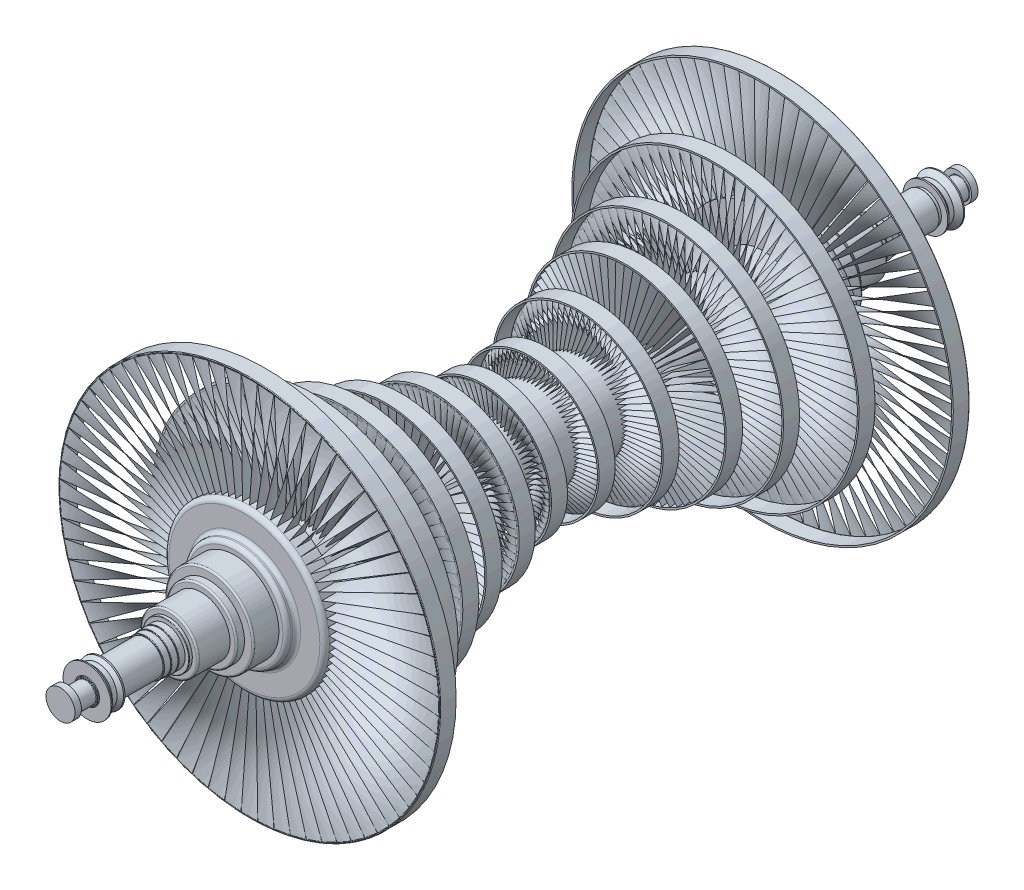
SolidWorks part; units mm, degrees
ref_plane "Front Plane" through (0, 0, 0) normal (0, 0, 1) x (1, 0, 0)
ref_plane "Top Plane" through (0, 0, 0) normal (0, 1, 0) x (1, 0, 0)
ref_plane "Right Plane" through (0, 0, 0) normal (1, 0, 0) x (0, 0, -1)
sketch "Sketch1" plane through (0, 0, 0) normal (0, 0, 1) x (1, 0, 0)
  circle A0 centre (0, 0) radius 50
  dimension "D1" = 100
extrude "Boss-Extrude1" add sketch "Sketch1" along normal blind 10
ref_plane "Plane1" through (0, 48, 0) normal (0, 1, 0) x (1, 0, 0)
ref_plane "Plane2" through (0, 118, 0) normal (0, 1, 0) x (1, 0, 0)
sketch "Sketch3" plane through (0, 48, 0) normal (0, 1, 0) x (1, 0, 0)
  line L0 (0, -10) -> (0, 0)
  line L1 (-50, -10) -> (50, -10) construction
  dimension "D1" = 10
sketch "Sketch6" plane through (0, 118, 0) normal (0, 1, 0) x (1, 0, 0)
  line L0 (-5, -10) -> (5, -10)
  line L1 (-50, -10) -> (50, -10) construction
  line L2 (0, -10) -> (0, 0) construction
surface "Surface-Loft3"
pattern_circular "CirPattern1" count 72 over 360 about axis through (0, 0, 10) along (0, 0, 1)
sketch "Sketch7" plane through (0, 0, 10) normal (0, 0, 1) x (1, 0, 0)
  circle A0 centre (0, 0) radius 50
extrude "Boss-Extrude2" add sketch "Sketch7" along normal blind 3 separate body
sketch "Sketch8" plane through (0, 0, 13) normal (0, 0, 1) x (1, 0, 0)
  circle A0 centre (0, 0) radius 32.5
  dimension "D1" = 65
extrude "Boss-Extrude3" add sketch "Sketch8" along normal blind 6
sketch "Sketch9" plane through (0, 0, 19) normal (0, 0, 1) x (1, 0, 0)
  circle A0 centre (0, 0) radius 27.5
  dimension "D1" = 55
extrude "Boss-Extrude4" add sketch "Sketch9" along normal blind 16
sketch "Sketch10" plane through (0, 0, 35) normal (0, 0, 1) x (1, 0, 0)
  circle A0 centre (0, 0) radius 22
extrude "Boss-Extrude5" add sketch "Sketch10" along normal blind 5
sketch "Sketch11" plane through (0, 0, 40) normal (0, 0, 1) x (1, 0, 0)
  circle A0 centre (0, 0) radius 18
  dimension "D1" = 36
extrude "Boss-Extrude6" add sketch "Sketch11" along normal blind 20
sketch "Sketch12" plane through (0, 0, 60) normal (0, 0, 1) x (1, 0, 0)
  circle A0 centre (0, 0) radius 14.5
  dimension "D1" = 29
extrude "Boss-Extrude7" add sketch "Sketch12" along normal blind 2
sketch "Sketch13" plane through (0, 0, 62) normal (0, 0, 1) x (1, 0, 0)
  circle A0 centre (0, 0) radius 12
extrude "Boss-Extrude8" add sketch "Sketch13" along normal blind 4
sketch "Sketch14" plane through (0, 0, 66) normal (0, 0, 1) x (1, 0, 0)
  circle A0 centre (0, 0) radius 11.5
extrude "Boss-Extrude9" add sketch "Sketch14" along normal blind 0.5
sketch "Sketch15" plane through (0, 0, 66.5) normal (0, 0, 1) x (1, 0, 0)
  circle A0 centre (0, 0) radius 12
extrude "Boss-Extrude10" add sketch "Sketch15" along normal blind 4
sketch "Sketch16" plane through (0, 0, 70.5) normal (0, 0, 1) x (1, 0, 0)
  circle A0 centre (0, 0) radius 11.5
  dimension "D1" = 23
extrude "Boss-Extrude11" add sketch "Sketch16" along normal blind 4
sketch "Sketch17" plane through (0, 0, 74.5) normal (0, 0, 1) x (1, 0, 0)
  circle A0 centre (0, 0) radius 10.75
  dimension "D1" = 21.5
extrude "Boss-Extrude12" add sketch "Sketch17" along normal blind 25
sketch "Sketch18" plane through (0, 0, 99.5) normal (0, 0, 1) x (1, 0, 0)
  circle A0 centre (0, 0) radius 10
  dimension "D1" = 20
extrude "Boss-Extrude13" add sketch "Sketch18" along normal blind 2
sketch "Sketch19" plane through (0, 0, 101.5) normal (0, 0, 1) x (1, 0, 0)
  circle A0 centre (0, 0) radius 14
extrude "Boss-Extrude14" add sketch "Sketch19" along normal blind 0.9
sketch "Sketch20" plane through (0, 0, 102.4) normal (0, 0, 1) x (1, 0, 0)
  circle A0 centre (0, 0) radius 14
extrude "Boss-Extrude15" add sketch "Sketch20" along normal blind 2 draft 45
sketch "Sketch21" plane through (0, 0, 104.4) normal (0, 0, 1) x (1, 0, 0)
  circle A0 centre (0, 0) radius 12
extrude "Boss-Extrude17" add sketch "Sketch21" along normal blind 3
sketch "Sketch22" plane through (0, 0, 107.4) normal (0, 0, 1) x (1, 0, 0)
  circle A0 centre (0, 0) radius 12
  dimension "D1" = 24
extrude "Boss-Extrude18" add sketch "Sketch22" along normal blind 3 draft 45
sketch "Sketch23" plane through (0, 0, 110.4) normal (0, 0, 1) x (1, 0, 0)
  circle A0 centre (0, 0) radius 15
extrude "Boss-Extrude20" add sketch "Sketch23" along normal blind 0.7
sketch "Sketch24" plane through (0, 0, 111.1) normal (0, 0, 1) x (1, 0, 0)
  circle A0 centre (0, 0) radius 7.5
  dimension "D1" = 15
extrude "Boss-Extrude21" add sketch "Sketch24" along normal blind 0.7
sketch "Sketch26" plane through (0, 0, 111.8) normal (0, 0, 1) x (1, 0, 0)
  circle A0 centre (0, 0) radius 6.5
  dimension "D1" = 13
extrude "Boss-Extrude22" add sketch "Sketch26" along normal blind 10.7
sketch "Sketch27" plane through (0, 0, 122.5) normal (0, 0, 1) x (1, 0, 0)
  circle A0 centre (-1.2013, 0) radius 9.0607
extrude "Boss-Extrude23" add sketch "Sketch27" along normal blind 4
fillet "Fillet2" radius 2.5 1 edges at (32.5, 0, 19)
fillet "Fillet3" radius 2.5 1 edges at (32.5, 0, 13)
fillet "Fillet4" radius 1 3 edges at (18, 0, 60) (22, 0, 40) (27.5, 0, 35)
fillet "Fillet5" radius 0.3 4 edges at (11.5, 0, 74.5) (12, 0, 70.5) (12, 0, 66) (14.5, 0, 62)
fillet "Fillet6" radius 0.3 3 edges at (6.5, 0, 111.8) (7.5, 0, 111.1) (7.5, 0, 111.8)
fillet "Fillet7" radius 0.3 1 edges at (6.5, 0, 122.5)
fillet "Fillet8" radius 0.3 1 edges at (10.75, 0, 99.5)
fillet "Fillet9" radius 3 1 edges at (50, 0, 13)
sketch "Sketch28" plane through (0, 0, 0) normal (1, 0, 0) x (0, 0, -1)
  line L0 (-10, 118.9868) -> (0, 118.9868)
  line L1 (0, 118.9868) -> (0, 117.9868)
  line L2 (0, 117.9868) -> (-10, 117.9868)
  line L3 (-10, 118.9868) -> (-10, 117.9868)
  dimension "D1" = 10
  dimension "D2" = 1
revolve "Revolve2" add sketch "Sketch28" angle 360 about axis through (0, 0, 99.5) along (0, 0, -1)
fillet "Fillet10" radius 0.4 1 edges at (118.9868, 0, 10)
fillet "Fillet11" radius 0.4 1 edges at (117.9868, 0, 10)
sketch "Sketch29" plane through (0, 0, 0) normal (0, 0, -1) x (-1, 0, 0)
  circle A0 centre (0, 0) radius 27.5 construction
  circle A1 centre (0, 0) radius 27.5
extrude "Boss-Extrude24" add sketch "Sketch29" along normal blind 155
ref_plane "Plane4" through (25, 0, 0) normal (1, 0, 0) x (0, 0, -1)
ref_plane "Plane5" through (90, 0, 0) normal (1, 0, 0) x (0, 0, -1)
sketch "Sketch30" plane through (25, 0, 0) normal (1, 0, 0) x (0, 0, -1)
  line L0 (20, 0) -> (30, 0)
  line L1 (155, 0) -> (0, 0) construction
  dimension "D1" = 10
  dimension "D2" = 20
sketch "Sketch31" plane through (90, 0, 0) normal (1, 0, 0) x (0, 0, -1)
  line L0 (20, 5) -> (20, -5)
  line L1 (20, 0) -> (30, 0) construction
surface "Surface-Loft4"
pattern_circular "CirPattern2" count 72 over 360 about axis through (0, 0, 13) along (0, 0, 1)
sketch "Sketch32" plane through (0, 0, 0) normal (0, 1, 0) x (1, 0, 0)
  line L0 (5, 20) -> (5, 30)
  line L1 (5, 30) -> (4, 30)
  line L2 (4, 30) -> (4, 20)
  line L3 (4, 20) -> (5, 20)
  dimension "D1" = 1
  dimension "D2" = 10
revolve "Revolve3" add sketch "Sketch32" angle 360 about axis through (0, 0, -155) along (0, 0, 1)
sketch "Sketch33" plane through (0, 0, 0) normal (1, 0, 0) x (0, 0, -1)
  line L1 (20, 89.2217) -> (30, 89.2217)
  line L2 (20, 89.2217) -> (20, 90.2217)
  line L3 (20, 90.2217) -> (30, 90.2217)
  line L4 (30, 89.2217) -> (30, 90.2217)
  dimension "D1" = 1
  dimension "D2" = 10
revolve "Revolve4" add sketch "Sketch33" angle 360 about axis through (0, 0, -155) along (0, 0, 1)
ref_plane "Plane6" through (0, 27, 0) normal (0, 1, 0) x (1, 0, 0)
ref_plane "Plane7" through (0, 72, 0) normal (0, 1, 0) x (1, 0, 0)
ref_plane "Plane8" through (0, 62, 0) normal (0, 1, 0) x (1, 0, 0)
ref_plane "Plane9" through (0, 52, 0) normal (0, 1, 0) x (1, 0, 0)
ref_plane "Plane10" through (0, 42, 0) normal (0, 1, 0) x (1, 0, 0)
sketch "Sketch36" plane through (0, 27, 0) normal (0, 1, 0) x (1, 0, 0)
  line L0 (0, 50) -> (0, 60)
  line L1 (0, 155) -> (0, 0) construction
  line L2 (0, 20) -> (0, 30) construction
  line L3 (90.2217, 30) -> (-90.2217, 30) construction
  dimension "D1" = 10
  dimension "D2" = 20
sketch "Sketch37" plane through (0, 72, 0) normal (0, 1, 0) x (1, 0, 0)
  line L0 (-5, 50) -> (5, 50)
  line L2 (0, 50) -> (0, 60) construction
surface "Surface-Loft5"
pattern_circular "CirPattern3" count 72 every 5 about axis through (0, 0, 13) along (0, 0, 1)
sketch "Sketch38" plane through (0, 0, 0) normal (1, 0, 0) x (0, 0, -1)
  line L0 (50, 72.1618) -> (60, 72.1618)
  line L1 (60, 72.1618) -> (60, 73.1618)
  line L2 (60, 73.1618) -> (50, 73.1618)
  line L3 (50, 73.1618) -> (50, 72.1618)
  dimension "D1" = 10
  dimension "D2" = 1
revolve "Revolve5" add sketch "Sketch38" angle 360 about axis through (0, 0, -155) along (0, 0, 1)
sketch "Sketch39" plane through (0, 27, 0) normal (0, 1, 0) x (1, 0, 0)
  line L0 (0, 80) -> (0, 90)
  line L1 (0, 155) -> (0, 0) construction
  line L2 (73.1618, 60) -> (-73.1618, 60) construction
  dimension "D1" = 10
  dimension "D2" = 20
sketch "Sketch40" plane through (0, 62, 0) normal (0, 1, 0) x (1, 0, 0)
  line L0 (-1.2127, 84.8507) -> (1.2127, 75.1493)
  line L2 (0, 80) -> (0, 90) construction
surface "Surface-Loft6"
pattern_circular "CirPattern4" count 72 every 5 about axis through (0, 0, 13) along (0, 0, 1)
sketch "Sketch41" plane through (0, 0, 0) normal (1, 0, 0) x (0, 0, -1)
  line L1 (75.1493, 61.6584) -> (85.1493, 61.6584)
  line L2 (75.1493, 61.6584) -> (75.1493, 62.6584)
  line L3 (75.1493, 62.6584) -> (85.1493, 62.6584)
  line L4 (85.1493, 61.6584) -> (85.1493, 62.6584)
  dimension "D1" = 10
  dimension "D2" = 1
revolve "Revolve6" add sketch "Sketch41" angle 360 about axis through (0, 0, -155) along (0, 0, 1)
sketch "Sketch42" plane through (0, 27, 0) normal (0, 1, 0) x (1, 0, 0)
  line L0 (0, 105.1493) -> (0, 115.1493)
  line L1 (0, 155) -> (0, 0) construction
  line L2 (62.6584, 85.1493) -> (-62.6584, 85.1493) construction
  dimension "D1" = 20
  dimension "D2" = 10
sketch "Sketch43" plane through (0, 52, 0) normal (0, 1, 0) x (1, 0, 0)
  line L0 (-5, 105.1493) -> (5, 105.1493)
  line L1 (0, 105.1493) -> (0, 115.1493) construction
surface "Surface-Loft7"
pattern_circular "CirPattern5" count 72 every 5 about axis through (0, 0, 13) along (0, 0, 1)
sketch "Sketch44" plane through (0, 0, 0) normal (1, 0, 0) x (0, 0, -1)
  line L1 (105.1493, 52.2379) -> (115.1493, 52.2379)
  line L2 (105.1493, 52.2379) -> (105.1493, 53.2379)
  line L3 (105.1493, 53.2379) -> (115.1493, 53.2379)
  line L4 (115.1493, 52.2379) -> (115.1493, 53.2379)
  dimension "D1" = 1
  dimension "D2" = 10
revolve "Revolve7" add sketch "Sketch44" angle 360 about axis through (0, 0, -155) along (0, 0, 1)
sketch "Sketch45" plane through (0, 27, 0) normal (0, 1, 0) x (1, 0, 0)
  line L0 (0, 135.1493) -> (0, 145.1493)
  line L1 (0, 155) -> (0, 0) construction
  line L2 (53.2379, 115.1493) -> (-53.2379, 115.1493) construction
  dimension "D1" = 20
  dimension "D2" = 10
sketch "Sketch46" plane through (0, 42, 0) normal (0, 1, 0) x (1, 0, 0)
  line L0 (-5, 135.1493) -> (5, 135.1493)
  line L2 (0, 135.1493) -> (0, 145.1493) construction
surface "Surface-Loft8"
pattern_circular "CirPattern6" count 72 every 5 about axis through (0, 0, 13) along (0, 0, 1)
sketch "Sketch47" plane through (0, 0, 0) normal (1, 0, 0) x (0, 0, -1)
  line L1 (135.1493, 42.276) -> (145.1493, 42.276)
  line L2 (135.1493, 42.276) -> (135.1493, 43.276)
  line L3 (135.1493, 43.276) -> (145.1493, 43.276)
  line L4 (145.1493, 42.276) -> (145.1493, 43.276)
  dimension "D1" = 1
  dimension "D2" = 10
revolve "Revolve8" add sketch "Sketch47" angle 360 about axis through (0, 0, -155) along (0, 0, 1)
mirror "Mirror7" about plane through (0, 0, -155) normal (0, 0, -1)
mirror "Mirror8" about plane through (0, 0, -155) normal (0, 0, -1)
mirror "Mirror10" about plane through (0, 0, -155) normal (0, 0, 1)
pattern_circular "CirPattern7" count 72 every 5 about axis through (0, 0, -323) along (0, 0, 1)
